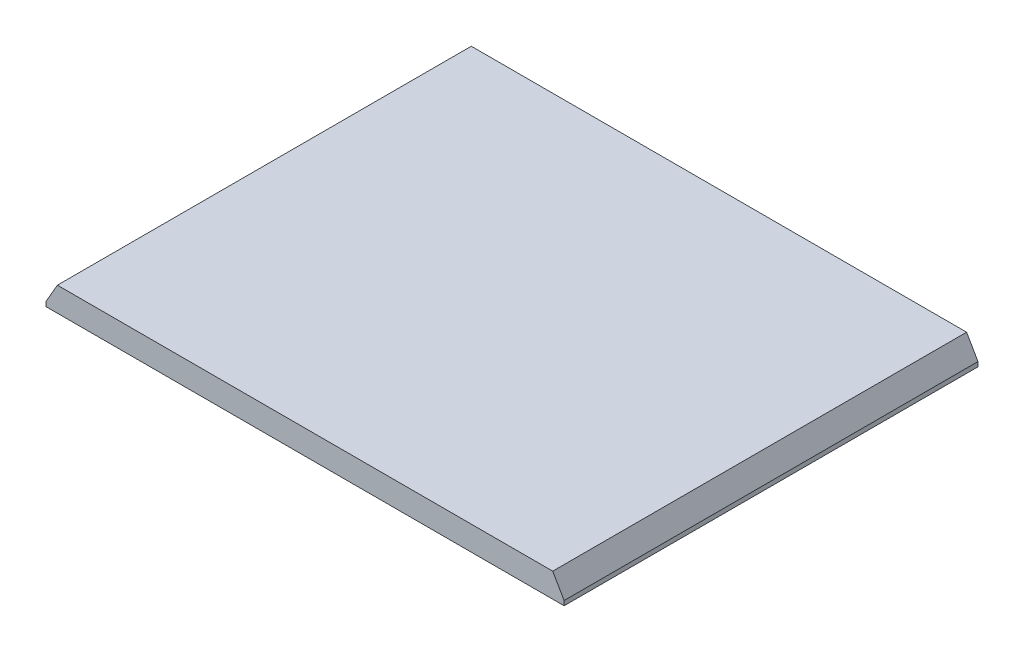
SolidWorks part; units mm, degrees
ref_plane "Front Plane" through (0, 0, 0) normal (1, 0, 0) x (0, 1, 0)
ref_plane "Top Plane" through (0, 0, 0) normal (0, 0, 1) x (0, 1, 0)
ref_plane "Right Plane" through (0, 0, 0) normal (0, 1, 0) x (-1, 0, 0)
sketch "sk w193" plane through (0, 0, 0) normal (0, 0, 1) x (0, 1, 0)
  point P0 (-399.034, -196.596)
  point P3 (-188.214, 0)
  line B0 (-399.034, -196.596) -> (-399.034, -160.02)
  line B1 (-399.034, -160.02) -> (-226.06, -160.02)
  line B2 (-210.82, -144.78) -> (-210.82, 144.78)
  line B3 (-226.06, 160.02) -> (-399.034, 160.02)
  line B4 (-399.034, 160.02) -> (-399.034, 196.596)
  line B5 (-399.034, 196.596) -> (0, 196.596)
  line B6 (0, 196.596) -> (0, 160.02)
  line B7 (0, 160.02) -> (-172.974, 160.02)
  line B8 (-188.214, 144.78) -> (-188.214, -144.78)
  line B9 (-172.974, -160.02) -> (0, -160.02)
  line B10 (0, -160.02) -> (0, -196.596)
  line B11 (0, -196.596) -> (-399.034, -196.596)
  arc B12 (-226.06, -160.02) -> (-210.82, -144.78) centre (-226.06, -144.78) ccw
  arc B13 (-210.82, 144.78) -> (-226.06, 160.02) centre (-226.06, 144.78) ccw
  arc B14 (-172.974, 160.02) -> (-188.214, 144.78) centre (-172.974, 144.78) ccw
  arc B15 (-188.214, -144.78) -> (-172.974, -160.02) centre (-172.974, -144.78) ccw
sketch_block_instance "w14x193-1-1"
sketch_block "w14x193-1" parameters "D4"=15.24, "D1"=399.034, "D2"=393.192, "D3"=22.606, "D5"=36.576
sketch "Sketch2" plane through (0, 0, 0) normal (0, 0, 1) x (0, 1, 0)
  line L0 (320, 501.4782) -> (320, -809.7231)
  line L1 (-188.214, 144.78) -> (-188.214, -144.78)
  line L2 (-188.214, -144.78) -> (-172.974, -160.02)
  line L3 (-172.974, -160.02) -> (5, -160.02)
  line L4 (-188.214, 144.78) -> (-172.974, 160.02)
  line L5 (-172.974, 160.02) -> (5, 160.02)
  line L6 (5, 201.596) -> (5, 160.02)
  line L7 (0, 196.596) -> (0, 160.02) construction
  line L8 (5, -160.02) -> (5, -201.596)
  line L9 (-285.82, 201.596) -> (5, 201.596)
  line L10 (-285.82, -201.596) -> (5, -201.596)
  line L11 (-285.82, 201.596) -> (-285.82, 239.696)
  line L12 (-285.82, 239.696) -> (167.6, 501.4782)
  line L13 (-285.82, -201.596) -> (-285.82, -239.696)
  line L14 (-285.82, -239.696) -> (167.6, -809.7231)
  line L15 (-210.82, -144.78) -> (-210.82, 144.78) construction
  line L16 (-399.034, 196.596) -> (0, 196.596) construction
  line L17 (0, -196.596) -> (-399.034, -196.596) construction
  line L18 (320, 501.4782) -> (167.6, 501.4782)
  line L19 (320, -809.7231) -> (167.6, -809.7231)
  point P30 (320, 501.4782)
  point P31 (320, -809.7231)
  dimension "D1" = 320
  dimension "D2" = 5
  dimension "D3" = 75
  dimension "D4" = 5
  dimension "D5" = 5
  dimension "D6" = 30
  dimension "D7" = 51.5
  dimension "D8" = 38.1
  dimension "D9" = 38.1
  dimension "D10" = 152.4
sketch "Sketch3" plane through (0, 0, 0) normal (0, 1, 0) x (-1, 0, 0)
  line L6 (-541.5415, 432.6) -> (541.5415, 432.6)
  line L7 (-541.5415, 432.6) -> (-541.5415, -432.6)
  line L8 (-541.5415, -432.6) -> (541.5415, -432.6)
  line L9 (541.5415, 432.6) -> (541.5415, -432.6)
  point P4 (0, 432.6)
  point P5 (541.5415, 0)
  dimension "D1" = 865.2
  dimension "D2" = 1083.083
extrude "Boss-Extrude1" add sketch "Sketch3" along normal blind 50.8
chamfer "Chamfer1" distance 41.275 angle 30 2 edges at (-541.5415, 50.8, 0) (541.5415, 50.8, 0)
